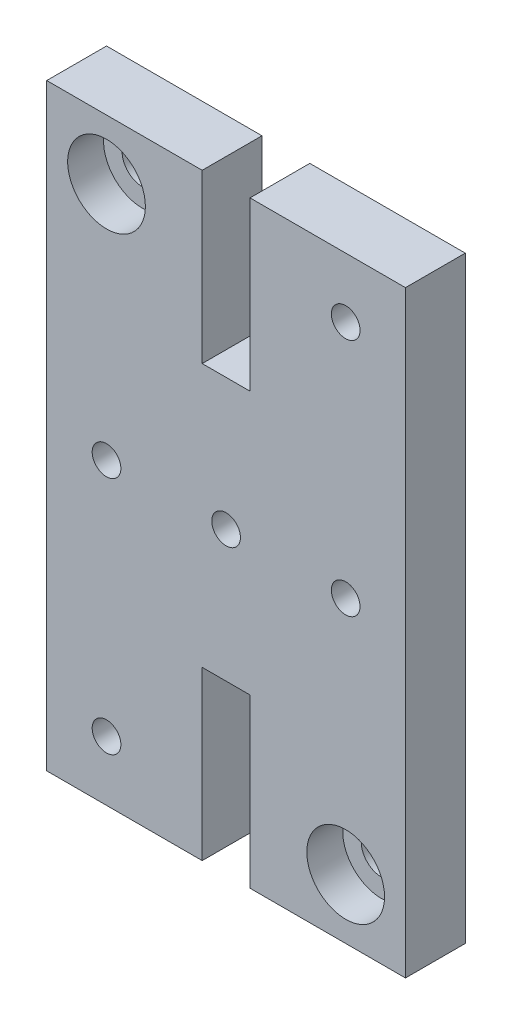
SolidWorks part; units mm, degrees
ref_plane "Face" through (0, 0, 0) normal (0, 0, 1) x (1, 0, 0)
ref_plane "Dessus" through (0, 0, 0) normal (0, 1, 0) x (1, 0, 0)
ref_plane "Droite" through (0, 0, 0) normal (1, 0, 0) x (0, 0, -1)
sketch "Esquisse1" plane through (0, 0, 0) normal (0, 0, 1) x (1, 0, 0)
  line L0 (15, 25) -> (15, -25) construction
  line L1 (15, -25) -> (2, -25) construction
  line L4 (-2, -25) -> (-15, -25) construction
  line L5 (-15, -25) -> (-15, 25) construction
  line L6 (-15, 25) -> (-2, 25) construction
  line L7 (-2, 25) -> (-2, 12.8452) construction
  line L8 (2, 12.8452) -> (2, 25) construction
  line L9 (2, 25) -> (15, 25) construction
  line L10 (15, 25) -> (15, -25)
  line L11 (15, -25) -> (2, -25)
  line L12 (-2, -11) -> (2, -11)
  line L13 (2, -11) -> (2, -25)
  line L14 (-2, -25) -> (-15, -25)
  line L15 (-15, -25) -> (-15, 25)
  line L16 (-15, 25) -> (-2, 25)
  line L17 (-2, 25) -> (-2, 11)
  line L18 (2, 11) -> (2, 25)
  line L19 (2, 25) -> (15, 25)
  line L20 (27.5511, 0) -> (-21.9185, 0) construction
  line L21 (-2, -25) -> (-2, -11)
  line L22 (-2, 11) -> (2, 11)
  dimension "D1" = 11
extrude "Extrusion1" add sketch "Esquisse1" along normal blind 5
hole_wizard "Chambrage pour vis à tête cylindrique à 6 pans creux (vis CHC) M31" positions "Esquisse3" profile "Esquisse2" counterbore size "M3" standard "ISO"
sketch "Esquisse3" plane through (0, 0, 5) normal (0, 0, 1) x (1, 0, 0)
  circle A0 centre (-10, 20) radius 1.2 construction
  circle A1 centre (10, -20) radius 1.2 construction
  point P0 (-10, 20)
  point P3 (10, -20)
sketch "Esquisse2" plane through (-10, 20, 5) normal (1, 0, 0) x (0, -1, 0)
  line L0 (0, 0) -> (0, 11.0215)
  line L1 (0, 11.0215) -> (1.7, 10)
  line L2 (1.7, 10) -> (1.7, 3)
  line L3 (1.7, 3) -> (3.25, 3)
  line L4 (3.25, 3) -> (3.25, 0)
  line L5 (3.25, 0) -> (0, 0)
  line L10 (0, 11.0215) -> (-1.7, 10) construction
  line L11 (0, -6.35) -> (0, 107.95) construction
  dimension "Diamètre du perçage" = 3.4
  dimension "Profondeur du perçage" = 10
  dimension "Diamètre du chambrage" = 6.5
  dimension "Profondeur du chambrage" = 3
  dimension "Angle de pointe" = 118
hole_wizard "Trou taraudé M3x0.51" positions "Esquisse5" profile "Esquisse4" tap size "M3x0.5" standard "ISO"
sketch "Esquisse5" plane through (0, 0, 5) normal (0, 0, 1) x (1, 0, 0)
  line L0 (-24.415, 0) -> (23.8016, 0) construction
  line L1 (-10, 20) -> (-10, -29.0772) construction
  line L2 (10, -20) -> (-20.9797, -20) construction
  line L3 (10, -20) -> (10, 29.0772) construction
  line L4 (-10, 20) -> (27.1141, 20) construction
  point P0 (10, 0)
  point P1 (10, 20)
  point P2 (0, 0)
  point P3 (-10, 0)
  point P4 (-10, -20)
sketch "Esquisse4" plane through (10, 0, 5) normal (1, 0, 0) x (0, -1, 0)
  line L0 (0, 0) -> (0, 5)
  line L1 (0, 5) -> (1.2, 5)
  line L2 (1.2, 5) -> (1.2, 0)
  line L5 (1.2, 0) -> (0, 0)
  line L11 (0, -6.35) -> (0, 107.95) construction
  dimension "Diamètre du trou pour taraudage jusqu'au prochain" = 2.4
  dimension "Profondeur du trou pour taraudage jusqu'au prochain" = 5
